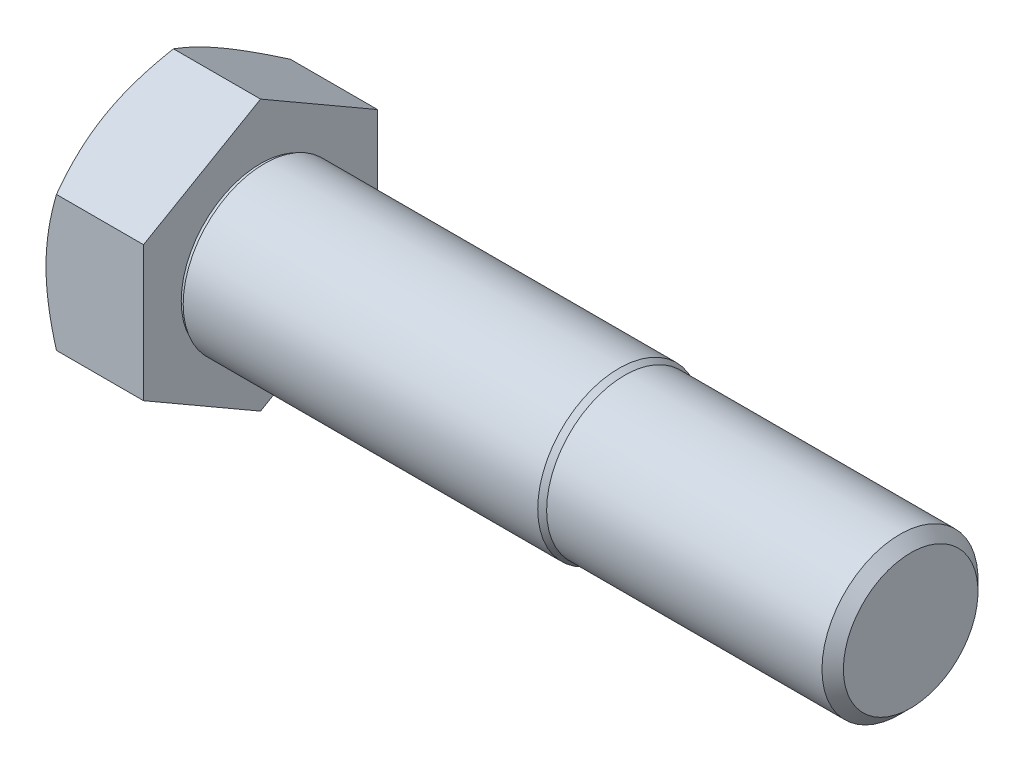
SolidWorks part; units mm, degrees
ref_plane "Front Plane" through (0, 0, 0) normal (0, 0, 1) x (1, 0, 0)
ref_plane "Top Plane" through (0, 0, 0) normal (0, 1, 0) x (1, 0, 0)
ref_plane "Right Plane" through (0, 0, 0) normal (1, 0, 0) x (0, 0, -1)
other "Configuration Table"
sketch "BaseHeadSke" plane through (0, 0, 0) normal (1, 0, 0) x (0, 0, -1)
  line L1 (0, 20.7846) -> (-18, 10.3923)
  line L2 (-18, 10.3923) -> (-18, -10.3923)
  line L3 (-18, -10.3923) -> (0, -20.7846)
  line L4 (0, -20.7846) -> (18, -10.3923)
  line L5 (18, -10.3923) -> (18, 10.3923)
  line L6 (18, 10.3923) -> (0, 20.7846)
  circle A0 centre (0, 0) radius 18 construction
  dimension "Width_flats" = 36
extrude "BaseHead" add sketch "BaseHeadSke" along normal blind 15
sketch "HeadChamferSke" plane through (0, 0, 0) normal (0, 0, 1) x (1, 0, 0)
  line L0 (0, 0) -> (36.4787, 0) construction
  line L1 (0, 10.3923) -> (0, -10.3923) construction
  line L2 (0, 20.7846) -> (0, 18)
  line L3 (0, 18) -> (1.6077, 20.7846)
  line L4 (1.6077, 20.7846) -> (0, 20.7846)
  line L7 (15, 20.7846) -> (0, 20.7846) construction
  dimension "Angle_Chamfer_Head" = 30
revolve "HeadChamfer" cut sketch "HeadChamferSke" angle 360 about L0
sketch "BodySke" plane through (0, 0, 0) normal (0, 0, 1) x (1, 0, 0)
  line L0 (0, 0) -> (144.9862, 0) construction
  line L1 (15, 12.2) -> (15.6, 12.2)
  line L2 (15, 10.3923) -> (15, -10.3923) construction
  line L3 (15.6, 12.2) -> (15.6, 12.5)
  line L4 (15.6, 12.5) -> (70.134, 12.5)
  line L5 (70.134, 12.5) -> (71, 12)
  line L6 (71, 12) -> (113.352, 12)
  line L7 (113.352, 12) -> (115, 10.352)
  line L8 (115, 10.352) -> (115, 0)
  line L9 (115, 0) -> (15, 0)
  line L10 (15, 0) -> (15, 12.2)
  line L11 (18, 0) -> (18, 23.2443) construction
  line L12 (78.5, 0) -> (78.5, 26.3648) construction
revolve "BaseBody" add sketch "BodySke" angle 360 about L0
sketch "ThdSchSke" plane through (0, 0, 0) normal (0, 0, 1) x (1, 0, 0)
  line L0 (0, 0) -> (125.7008, 0) construction
  line L1 (110.352, 13.9029) -> (110.352, 12)
  line L2 (110.352, 13.9029) -> (112.2549, 13.9029)
  line L3 (112.2549, 13.9029) -> (112.2549, 12)
  line L4 (112.2549, 12) -> (111.3035, 10.352)
  line L5 (111.3035, 10.352) -> (110.352, 12)
revolve "ThreadSchematic" [suppressed] cut sketch "ThdSchSke" angle 360 about L0
pattern_linear "ThdSchPat" [suppressed]
equation "\"D3@BodySke\" = \"Advance@BodySke\" * 2.5"
equation "\"Thread_length@ThreadCosmetic\" = \"Thread_length@BodySke\""
equation "\"Thread_minor@ThreadCosmetic\" = \"Thread_minor@BodySke\""
equation "\"D1@ThdSchSke\" = \"Advance@BodySke\""
equation "\"Tooth_Num@ThdSchPat\" =  int( \"Thread_length@BodySke\" / \"Advance@BodySke\" ) - 1 "
equation "\"Advance@ThdSchPat\" = \"Advance@BodySke\""
